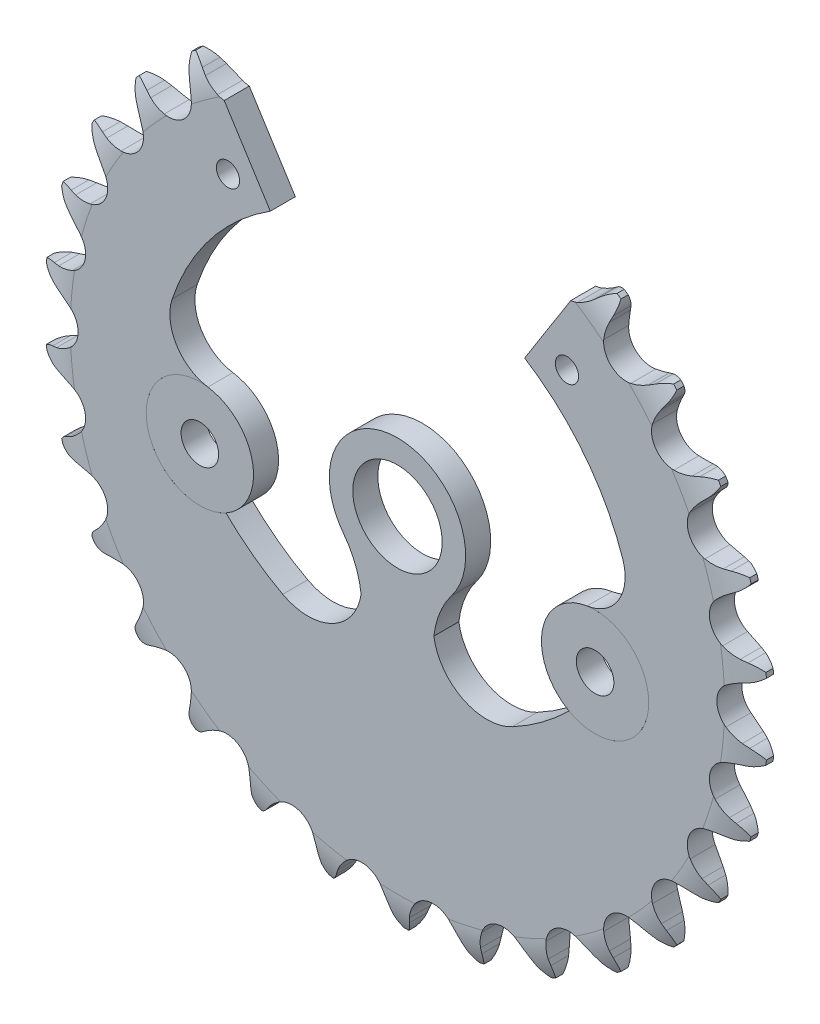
SolidWorks part; units mm, degrees
ref_plane "Front Plane" through (0, 0, 0) normal (0, 0, 1) x (1, 0, 0)
ref_plane "Top Plane" through (0, 0, 0) normal (0, 1, 0) x (1, 0, 0)
ref_plane "Right Plane" through (0, 0, 0) normal (1, 0, 0) x (0, 0, -1)
sketch "Sketch0" plane through (0, 0, 0) normal (0, 0, 1) x (1, 0, 0)
  line L0 (4, -38.0575) -> (0, 0) construction
  line L1 (0, 0) -> (11.8252, -36.3942) construction
  line L2 (0, 0) -> (-4, -38.0575) construction
  line L3 (4, -38.0575) -> (11.8252, -36.3942) construction
  line L4 (4, -38.0575) -> (-4, -38.0575) construction
  line L5 (7.2275, -38.4357) -> (6.9181, -37.8251)
  line L6 (4, -38.0575) -> (0, -38.4779) construction
  line L7 (0.9217, -39.0985) -> (1.0973, -38.4369)
  line L8 (0, -38.0575) -> (0, -40.4575) construction
  line L9 (5.8654, -36.318) -> (1.0746, -40.7855) construction
  line L10 (0, 0) -> (0, -38.0575) construction
  line L11 (6.9181, -37.8251) -> (1.0746, -40.7855) construction
  line L12 (0, -40.4575) -> (0, -40.7894) construction
  line L13 (10.847, -36.6021) -> (7.2275, -38.4357) construction
  circle A0 centre (0, 0) radius 40.4575 construction
  circle A1 centre (0, 0) radius 38.2671 construction
  arc A2 (-3.3189, -42.1025) -> (11.9999, -40.4924) centre (0, 0) ccw
  circle A3 centre (0, 0) radius 40.7894 construction
  circle A4 centre (4, -38.0575) radius 2.5 construction
  arc A7 (5.8654, -36.318) -> (1.8137, -36.7438) centre (4, -38.0575) ccw
  circle A8 centre (4, -38.0575) radius 2.5506 construction
  arc A9 (7.2275, -38.4357) -> (11.9999, -40.4924) centre (10.847, -36.6021) ccw
  arc A10 (6.9181, -37.8251) -> (5.8654, -36.318) centre (1.0746, -40.7855) ccw
  arc A11 (0.9217, -39.0985) -> (-3.3189, -42.1025) centre (-3, -38.0575) cw
  arc A12 (1.0973, -38.4369) -> (1.8137, -36.7438) centre (7.4287, -40.1176) cw
sketch "Sketch1" plane through (0, 0, 0) normal (1, 0, 0) x (0, 0, -1)
  line L0 (1.4, 0) -> (-1.4, 0)
  line L1 (-1.4, 0) -> (-1.4, 36.5845)
  line L2 (-1.4, 38.2671) -> (0, 38.2671) construction
  line L3 (-0.4, 40.4575) -> (0.4, 40.4575)
  line L5 (1.4, 36.5845) -> (1.4, 0)
  line L7 (0, 40.4575) -> (0, 0) construction
  line L8 (-1.4, 36.5845) -> (1.4, 36.5845) construction
  line L9 (0, 40.4575) -> (0, -40.4575) construction
  line L10 (-1.4, 36.5845) -> (-1.4, 40.4575) construction
  line L11 (-1.4, 40.4575) -> (-0.4, 40.4575) construction
  line L12 (0.4, 40.4575) -> (1.4, 40.4575) construction
  line L13 (1.4, 40.4575) -> (1.4, 36.5845) construction
  line L14 (0, 0) -> (-6.4008, 0) construction
  line L15 (-1.4, 38.2671) -> (-1.4, 32.9671) construction
  line L22 (1.4, 0) -> (-14.6, 0) construction
  line L24 (-1.4, 0) -> (-1.4, 32.9671) construction
  arc A0 (-0.4, 40.4575) -> (-1.4, 36.5845) centre (6.6, 36.5845) ccw
  arc A1 (0.4, 40.4575) -> (1.4, 36.5845) centre (-6.6, 36.5845) cw
revolve "Revolve1" add sketch "Sketch1" angle 360 mid plane about L0
extrude "Cut-Extrude1" cut sketch "Sketch0" against normal through all and the other way through all
pattern_circular "CirPattern1" count 30 over 360 about axis through (0, 0, 0) along (0, 0, 1) of "Cut-Extrude1"
sketch "Sketch2" plane through (0, 0, 0) normal (0, 0, 1) x (1, 0, 0)
  circle A0 centre (0, 0) radius 5 construction
  circle A1 centre (0, 0) radius 20
  circle A2 centre (0, 0) radius 40.455 construction
  dimension "Bore" = 10
  dimension "Hub Dia." = 40
  dimension "OD" = 80.91
extrude "Boss-Extrude1" add sketch "Sketch2" along normal up to vertex (14.6 mm away) from surface at 1.4
sketch "Sketch3" plane through (0, 0, 0) normal (0, 0, 1) x (1, 0, 0)
  circle A0 centre (0, 0) radius 5 construction
  circle A1 centre (0, 0) radius 5
extrude "Cut-Extrude2" cut sketch "Sketch3" along normal through all and the other way through all
sketch "Sketch4" plane through (0, 0, 0) normal (1, 0, 0) x (0, 0, -1)
  line L0 (-14.6, 20) -> (-14.6, 19.5)
  line L1 (-1.4, 40.4575) -> (-3.5, 40.4575)
  line L2 (-1.4, 40.4575) -> (-1.4, 32.9671)
  line L3 (-1.4, 32.9671) -> (-3.5, 32.9671)
  line L4 (-3.5, 40.4575) -> (-3.5, 32.9671)
  line L9 (-14.6, 19.5) -> (-14.1, 20)
  line L10 (-14.1, 20) -> (-14.6, 20)
revolve "Cut-Revolve1" cut sketch "Sketch4" angle 360 mid plane about L22
sketch "Sketch6" plane through (0, 0, 14.6) normal (0, 0, 1) x (1, 0, 0)
  circle A0 centre (0, 0) radius 20
  dimension "D1" = 40
extrude "Cut-Extrude4" cut sketch "Sketch6" against normal up to surface (13.2 mm away)
ref_plane "Plane1" through (0, 0, 0) normal (0, 0, 1) x (1, 0, 0)
sketch "Sketch7" plane through (0, 0, 0) normal (0, 0, 1) x (1, 0, 0)
  circle A0 centre (0, 0) radius 5
  dimension "D1" = 10
sketch "Sketch8" plane through (0, 0, 1.4) normal (0, 0, 1) x (1, 0, 0)
  line L0 (0, 0) -> (0, -36.5845) construction
  line L1 (0, 0) -> (22.1009, -4.0005) construction
  arc A0 (-1.9557, -36.5322) -> (1.9557, -36.5322) centre (0, 0) ccw construction
  circle A1 centre (22.1009, -4.0005) radius 6
  circle A2 centre (-22.1009, -4.0005) radius 6
  dimension "D3" = 12
  dimension "D1" = 79.74
  dimension "D2" = 22.46
extrude "Boss-Extrude3" add sketch "Sketch8" along normal blind 0.0001
sketch "Sketch9" plane through (0, 0, 1.4) normal (0, 0, 1) x (1, 0, 0)
  line L0 (0, 0) -> (0, -36.5845) construction
  line L1 (-4, -10.707) -> (-4, -8.6608)
  line L2 (4, -10.707) -> (4, -8.6608)
  line L3 (-4, 0) -> (-4, -36.5845) construction
  line L4 (4, 0) -> (4, -36.5845) construction
  line L5 (-4, -36.3651) -> (-4, -36.5845)
  line L6 (4, -36.3651) -> (4, -36.5845)
  circle A0 centre (0, 0) radius 36.5845 construction
  arc A1 (-20.6316, -16.7652) -> (20.6316, -16.7652) centre (0, 0) ccw
  arc A2 (-19.8908, 30.7047) -> (-23.0553, 28.4056) centre (0, 0) ccw construction
  circle A3 centre (22.1009, -4.0005) radius 6 construction
  circle A4 centre (-22.1009, -4.0005) radius 6 construction
  arc A5 (21.2057, 1.9324) -> (19.1829, -9.2431) centre (22.1009, -4.0005) ccw
  arc A6 (-19.1829, -9.2431) -> (-21.2057, 1.9324) centre (-22.1009, -4.0005) ccw
  circle A7 centre (0, 0) radius 26.5845 construction
  arc A8 (25.1993, 8.4693) -> (-25.1993, 8.4693) centre (0, 0) ccw
  arc A9 (19.1829, -9.2431) -> (20.6316, -16.7652) centre (16.7512, -13.612) cw
  arc A10 (-19.1829, -9.2431) -> (-20.6316, -16.7652) centre (-16.7512, -13.612) ccw
  arc A11 (-21.2057, 1.9324) -> (-25.1993, 8.4693) centre (-20.4598, 6.8764) cw
  arc A12 (21.2057, 1.9324) -> (25.1993, 8.4693) centre (20.4598, 6.8764) ccw
  arc A13 (6.0567, -4.6321) -> (-6.0567, -4.6321) centre (0, 0) ccw
  arc A14 (-4, -10.707) -> (-6.0567, -4.6321) centre (-14, -10.707) ccw
  arc A15 (4, -10.707) -> (6.0567, -4.6321) centre (14, -10.707) cw
  arc A16 (-19.1829, -9.2431) -> (-12.834, -13.9493) centre (0, 10) ccw
  arc A17 (12.834, -13.9493) -> (19.1829, -9.2431) centre (0, 10) ccw
  arc A18 (4, -8.6608) -> (12.834, -13.9493) centre (10, -8.6608) ccw
  arc A19 (-4, -8.6608) -> (-12.834, -13.9493) centre (-10, -8.6608) cw
  point P24 (26.5845, -0.0133)
  point P44 (4, -16.8753)
  dimension "D2" = 5
  dimension "D3" = 5
  dimension "D4" = 15.25
  dimension "D7" = 10
  dimension "D9" = 6
  dimension "D8" = 10
  dimension "D1" = 10
  dimension "D5" = 4
  dimension "D6" = 4
extrude "Cut-Extrude5" cut sketch "Sketch9" against normal through all contours A19 L1 A14 A13 A15 L2 A18 A17 A5 A12 A8 A11 A6 A16
sketch "Sketch14" plane through (0, 0, 1.4001) normal (0, 0, 1) x (1, 0, 0)
  circle A0 centre (-22.1009, -4.0005) radius 6 construction
  circle A1 centre (22.1009, -4.0005) radius 6 construction
hole_wizard "M5x0.8 Tapped Hole3" positions "Sketch17" profile "Sketch18" tap size "M5x0.8" standard "ANSI Metric"
sketch "Sketch17" plane through (0, 0, -1.4) normal (0, 0, -1) x (-1, 0, 0)
  point P0 (-22.1009, -4.0005)
  point P3 (22.1009, -4.0005)
sketch "Sketch18" plane through (22.1009, -4.0005, -1.4) normal (1, 0, 0) x (0, 1, 0)
  line L0 (0, 0) -> (0, 3.1211)
  line L1 (0, 3.1211) -> (2.1, 3.1211)
  line L2 (2.1, 3.1211) -> (2.1, 0)
  line L5 (2.1, 0) -> (0, 0)
  line L11 (0, -6.35) -> (0, 107.95) construction
  dimension "Thru Tap Drill Dia." = 4.2
  dimension "Thru Tap Drill Depth" = 3.1211
sketch "Sketch21" plane through (0, 0, -1.4) normal (0, 0, -1) x (-1, 0, 0)
  line L0 (0, 36.5845) -> (0, 26.5845) construction
  line L1 (0, 0) -> (20, 31.5845) construction
  line L2 (0, 31.5845) -> (20, 31.5845) construction
  line L3 (0, 26.5845) -> (0, 40.4575)
  line L4 (14.2223, 22.4602) -> (25.6186, 40.4575)
  line L5 (25.6186, 40.4575) -> (-25.6186, 40.4575)
  line L6 (-14.2223, 22.4602) -> (-25.6186, 40.4575)
  arc A0 (0.2723, 40.4565) -> (-0.2723, 40.4565) centre (0, 0) ccw construction
  arc A2 (1.9557, 36.5322) -> (-1.9557, 36.5322) centre (0, 0) ccw construction
  arc A3 (25.1993, 8.4693) -> (-25.1993, 8.4693) centre (0, 0) ccw construction
  arc A4 (-14.2223, 22.4602) -> (14.2223, 22.4602) centre (0, 0) cw
  dimension "D1" = 20
extrude "Cut-Extrude7" cut sketch "Sketch21" against normal through all contours L6 A4 L3 L5 | L3 A4 L4 L5
sketch "Sketch22" plane through (0, 0, -1.4) normal (0, 0, -1) x (-1, 0, 0)
  point P0 (-18.9546, 23.6834)
  point P1 (18.9546, 23.6834)
  dimension "D1" = 23.6834
  dimension "D2" = 23.6834
  dimension "D3" = 18.9546
  dimension "D4" = 18.9546
hole_wizard "M2 Tapped Hole1" positions "3DSketch1" profile "Sketch23" tap size "M2" standard "ISO"
sketch3d "3DSketch1"
  point P0 (18.9546, 23.6834, -1.4)
  point P3 (-18.9546, 23.6834, -1.4)
sketch "Sketch23" plane through (18.9546, 23.6834, -1.4) normal (1, 0, 0) x (0, 1, 0)
  line L0 (0, 0) -> (0, 3.1211)
  line L1 (0, 3.1211) -> (1.3, 3.1211)
  line L2 (1.3, 3.1211) -> (1.3, 0)
  line L5 (1.3, 0) -> (0, 0)
  line L11 (0, -6.35) -> (0, 107.95) construction
  dimension "Thru Tap Drill Dia." = 2.6
  dimension "Thru Tap Drill Depth" = 3.1211
equation "\"360/N@Sketch0\" = 360/\"Teeth@CirPattern1\""
equation "\"Ds@Sketch0\" = 1.005 * \"Dr@Sketch0\" + ( 0.003 * 25.4 ) "
equation "\"R@Sketch0\" = 1/2 * \"Ds@Sketch0\""
equation "\"A@Sketch0\" = 35 +  ( 60 / \"Teeth@CirPattern1\" ) "
equation "\"B@Sketch0\" = 18 -  ( 56 / \"Teeth@CirPattern1\" )"
equation "\"ac@Sketch0\" = 0.8 * \"Dr@Sketch0\""
equation "\"ab@Sketch0\" = 1.4 * \"Dr@Sketch0\""
equation "\"J@Sketch0\" = 0.3 * \"Pitch@Sketch0\""
equation "\"D3@Sketch4\" = \"t@Sketch1\" * 3 / 4"
